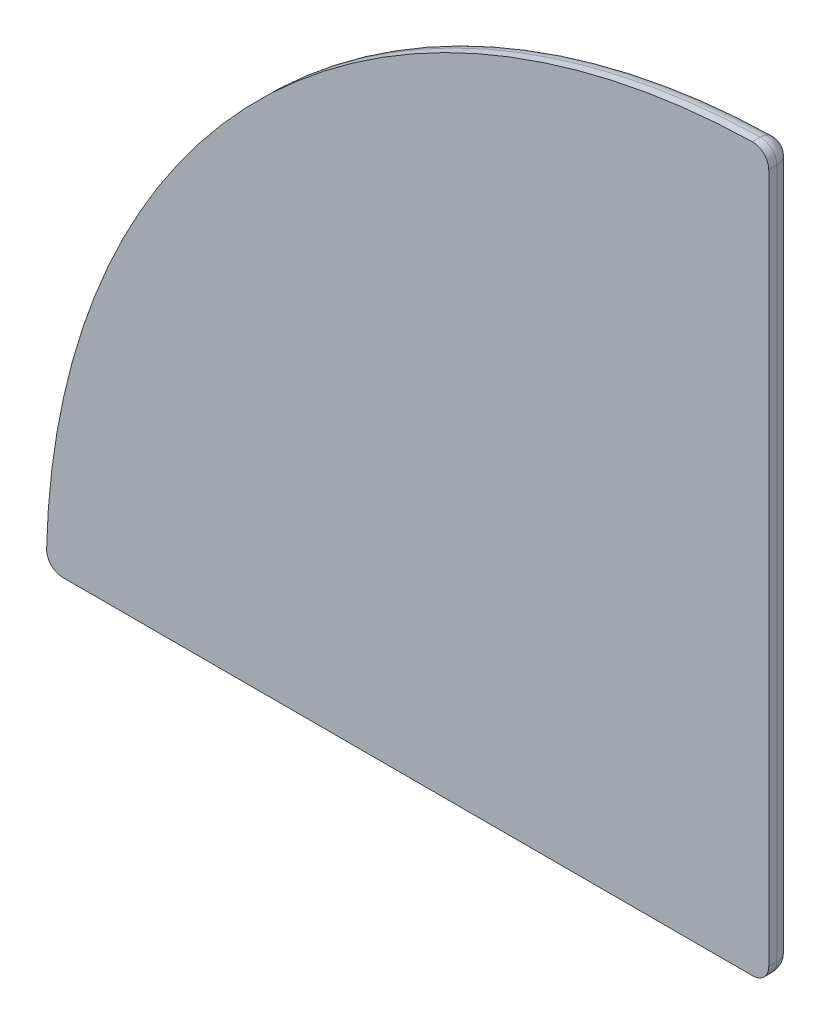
SolidWorks part; units mm, degrees
ref_plane "Front Plane" through (0, 0, 0) normal (0, 0, 1) x (1, 0, 0)
ref_plane "Top Plane" through (0, 0, 0) normal (0, 1, 0) x (1, 0, 0)
ref_plane "Right Plane" through (0, 0, 0) normal (1, 0, 0) x (0, 0, -1)
ref_plane "Plane1" through (0, 0, 0) normal (0, -1, 0) x (1, 0, 0)
sketch "Sketch1" plane through (0, 0, 0) normal (0, -1, 0) x (1, 0, 0)
  line L0 (0, 3) -> (-90, 3)
  line L1 (-90, 3) -> (-90, 0)
  line L2 (-90, 0) -> (0, 0)
  line L3 (0, 0) -> (0, 3)
  line L4 (0, 0) -> (0, 3) construction
revolve "Revolve1" add sketch "Sketch1" angle 90 about L4
fillet "Fillet1" radius 2 6 edges at (0, 90, 1.5) (-90, 0, 1.5) (-63.6396, 63.6396, 0) (0, 45, 0) (-45, 0, 0) (0, 0, 1.5)
sketch "Sketch3" plane through (0, 0, 0) normal (0, 0, -1) x (-1, 0, 0)
  text T0 "<i>GreenLab</i>" font "Copperplate Gothic Bold" height 3.5
extrude "Cut-Extrude1" cut sketch "Sketch3" against normal blind 0.5
